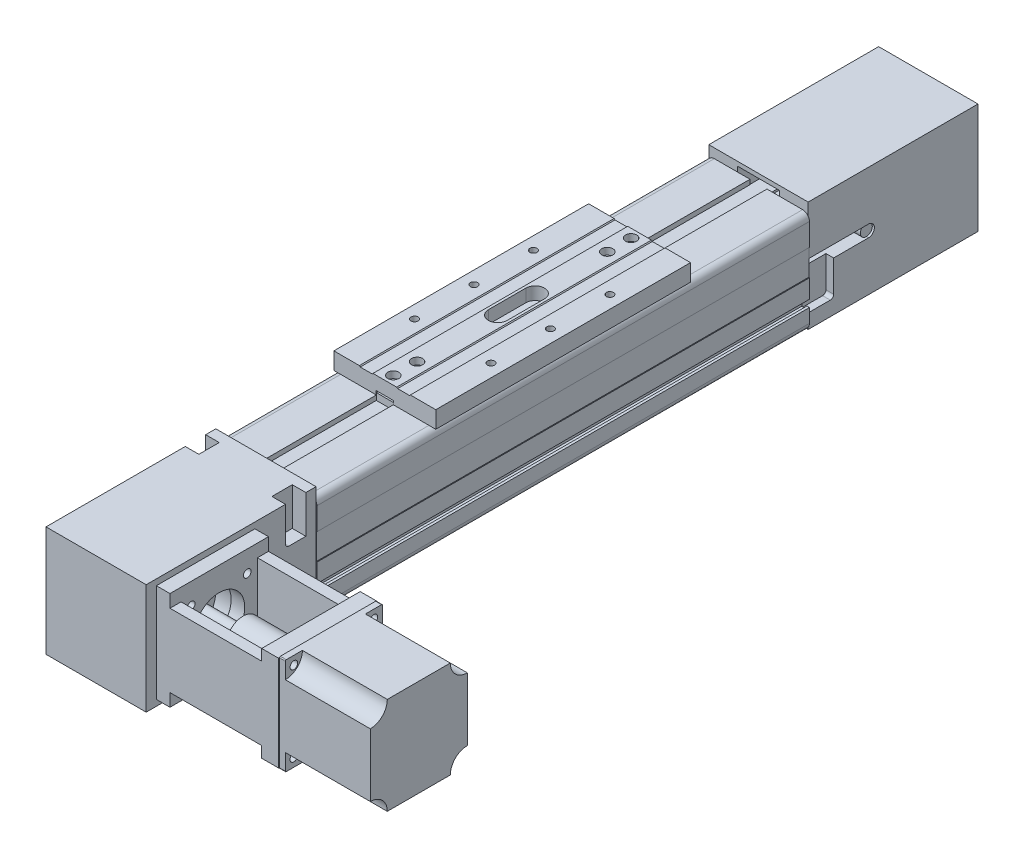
SolidWorks part; units mm, degrees
ref_plane "前视基准面" through (0, 0, 0) normal (0, 0, 1) x (1, 0, 0)
ref_plane "上视基准面" through (0, 0, 0) normal (0, 1, 0) x (1, 0, 0)
ref_plane "右视基准面" through (0, 0, 0) normal (1, 0, 0) x (0, 0, -1)
sketch "草图2" plane through (0, 0, 0) normal (0, 0, 1) x (1, 0, 0)
  line L0 (-87.6981, 0) -> (87.6981, 0) construction
  line L1 (0, -69.616) -> (0, 69.616) construction
  line L2 (-29.25, -32.5) -> (-29.25, 32.5)
  line L3 (29.25, -32.5) -> (29.25, 32.5)
  line L4 (-29.25, 32.5) -> (29.25, 32.5)
  line L5 (-29.25, -32.5) -> (29.25, -32.5)
  point P6 (0, 0)
  point P8 (-29.25, 0)
  point P12 (29.25, 0)
  dimension "D1" = 65
  dimension "D2" = 58.5
extrude "拉伸1" add sketch "草图2" along normal blind 100
sketch "草图3" plane through (0, 0, 100) normal (0, 0, 1) x (1, 0, 0)
  line L0 (0, -29.8615) -> (0, 29.8615) construction
  line L1 (-24.9311, 0) -> (24.9311, 0) construction
  line L2 (-12.5, -30) -> (-12.5, 30)
  line L3 (12.5, -30) -> (12.5, 30)
  line L4 (-12.5, 30) -> (12.5, 30)
  line L5 (-12.5, -30) -> (12.5, -30)
  point P6 (0, 0)
  point P8 (-12.5, 0)
  point P20 (12.5, 0)
  dimension "D1" = 25
  dimension "D2" = 30
extrude "拉伸2" cut sketch "草图3" against normal blind 52
sketch "草图4" plane through (-29.25, 0, 0) normal (-1, 0, 0) x (0, 0, 1)
  line L0 (0, 0) -> (100, 0) construction
  line L1 (100, 32.5) -> (100, -32.5) construction
  line L2 (64.5, 3.5) -> (100, 3.5)
  line L3 (64.5, -3.5) -> (100, -3.5)
  line L4 (100, -3.5) -> (100, 3.5)
  arc A0 (64.5, 3.5) -> (64.5, -3.5) centre (64.5, 0) ccw
  dimension "D1" = 7
  dimension "D2" = 35.5
extrude "拉伸3" cut sketch "草图4" against normal through all
sketch "草图5" plane through (-29.25, 0, 0) normal (-1, 0, 0) x (0, 0, 1)
  line L1 (100, -3.5) -> (85, -3.5)
  line L8 (64.5, -3.5) -> (100, -3.5) construction
  line L9 (85, -3.5) -> (85, -22)
  line L10 (87, -24) -> (100, -24)
  line L11 (100, -3.5) -> (100, -32.5) construction
  line L12 (100, -24) -> (100, -3.5)
  line L13 (100, -32.5) -> (0, -32.5) construction
  arc A1 (85, -22) -> (87, -24) centre (87, -22) ccw
  dimension "D6" = 2
  dimension "D4" = 8.5
  dimension "D5" = 15
extrude "拉伸4" cut sketch "草图5" against normal blind 4.5
mirror "镜向1" about plane through (0, 0, 0) normal (1, 0, 0) of "拉伸4"
sketch "草图10" plane through (-29.25, 0, 0) normal (-1, 0, 0) x (0, 0, 1)
  line L0 (64.5, 3.5) -> (64.5, -3.5) construction
  point P4 (64.5, 0)
ref_plane "基准面1" through (0, 0, 64.5) normal (0, 0, 1) x (1, 0, 0)
sketch "草图11" plane through (0, 0, 64.5) normal (0, 0, 1) x (1, 0, 0)
  line L0 (-29.25, 0) -> (29.25, 0) construction
  line L1 (29.25, -3.5) -> (29.25, 3.5) construction
  line L2 (0, 32.5) -> (0, -32.5) construction
  line L3 (29.25, 32.5) -> (-29.25, 32.5) construction
  line L4 (-29.25, -32.5) -> (29.25, -32.5) construction
  line L5 (-28, 0) -> (-28, 3.5)
  line L6 (-28, 3.5) -> (-10, 3.5)
  line L7 (-10, 3.5) -> (-10, 25)
  line L8 (-10, 25) -> (-5.2, 25)
  line L9 (-5.2, 25) -> (-5.2, 24)
  line L10 (-5.2, 24) -> (5.2, 24)
  line L11 (28, 0) -> (28, 3.5)
  line L12 (28, 3.5) -> (10, 3.5)
  line L13 (5.2, 25) -> (5.2, 24)
  line L14 (10, 25) -> (5.2, 25)
  line L15 (10, 3.5) -> (10, 25)
  line L16 (-28, 0) -> (28, 0)
  point P22 (0, 24)
  dimension "D1" = 56
  dimension "D2" = 10.4
  dimension "D3" = 20
  dimension "D4" = 25
  dimension "D5" = 24
revolve "旋转1" add sketch "草图11" angle 360 about L16
ref_plane "基准面2" through (0, 0, 390) normal (0, 0, 1) x (1, 0, 0)
sketch "草图12" plane through (0, 0, 390) normal (0, 0, 1) x (1, 0, 0)
  line L0 (0, -39.1606) -> (0, 39.1606) construction
  line L1 (-32.9855, 0) -> (32.9855, 0) construction
  line L2 (-29.5, 32.5) -> (-29.5, -32.5)
  line L3 (-29.5, 32.5) -> (29.5, 32.5)
  line L4 (29.5, 32.5) -> (29.5, -32.5)
  line L5 (-29.5, -32.5) -> (29.5, -32.5)
  point P6 (0, 0)
  point P9 (0, -32.5)
  point P11 (0, 32.5)
  point P12 (29.5, 0)
  point P13 (-29.5, 0)
  dimension "D1" = 65
  dimension "D2" = 59
extrude "拉伸9" add sketch "草图12" along normal blind 100
sketch "草图13" plane through (0, 32.5, 0) normal (0, 1, 0) x (1, 0, 0)
  line L0 (0, -390) -> (0, -490) construction
  line L1 (29.5, -390) -> (-29.5, -390) construction
  line L2 (29.5, -490) -> (-29.5, -490) construction
  line L3 (29.5, -490) -> (29.5, -390) construction
  line L4 (29.5, -396) -> (21.5, -396)
  line L5 (29.5, -396) -> (29.5, -408)
  line L6 (29.5, -408) -> (21.5, -408)
  line L7 (21.5, -396) -> (21.5, -408)
  line L8 (-21.5, -396) -> (-21.5, -408)
  line L9 (-29.5, -408) -> (-21.5, -408)
  line L10 (-29.5, -396) -> (-29.5, -408)
  line L11 (-29.5, -396) -> (-21.5, -396)
  dimension "D1" = 6
  dimension "D2" = 12
  dimension "D3" = 8
extrude "拉伸10" cut sketch "草图13" against normal blind 22.3
fillet "圆角1" radius 2 2 edges at (25.5, 10.2, 408) (-25.5, 10.2, 408)
sketch "草图16" plane through (-29.5, 0, 0) normal (-1, 0, 0) x (0, 0, 1)
  line L0 (490, -32.5) -> (390, -32.5) construction
  line L1 (490, 32.5) -> (490, -32.5) construction
  line L2 (455, -3.5) -> (455, 11.1352) construction
  circle A0 centre (455, -3.5) radius 18.5
  dimension "D2" = 37
  dimension "D1" = 35
  dimension "D3" = 29
extrude "拉伸13" cut sketch "草图16" against normal through all
sketch "草图17" plane through (0, 0, 390) normal (0, 0, -1) x (-1, 0, 0)
  line L0 (0, 0) -> (7.3583, 0) construction
  line L1 (0, 0) -> (0, 21.2702) construction
  line L2 (-15, 24.5) -> (15, 24.5) construction
  line L3 (-15, -24.5) -> (15, -24.5) construction
  line L4 (-15, 28.5) -> (15, 28.5)
  line L5 (-15, 20.5) -> (15, 20.5)
  line L6 (-15, -20.5) -> (15, -20.5)
  line L7 (-15, -28.5) -> (15, -28.5)
  arc A0 (15, 20.5) -> (15, 28.5) centre (15, 24.5) ccw
  arc A1 (-15, 20.5) -> (-15, 28.5) centre (-15, 24.5) cw
  arc A2 (-15, -20.5) -> (-15, -28.5) centre (-15, -24.5) ccw
  arc A3 (15, -20.5) -> (15, -28.5) centre (15, -24.5) cw
  point P7 (0, 24.5)
  point P17 (0, -24.5)
  point P18 (0, -21.2702)
  dimension "D3" = 8
  dimension "D1" = 30
  dimension "D2" = 49
extrude "拉伸14" cut sketch "草图17" against normal blind 90
sketch "草图18" plane through (-29.5, 0, 0) normal (-1, 0, 0) x (0, 0, 1)
  point P0 (455, -3.5)
ref_plane "基准面3" through (0, 0, 455) normal (0, 0, 1) x (1, 0, 0)
sketch "草图19" plane through (0, 0, 455) normal (0, 0, 1) x (1, 0, 0)
  line L0 (0, 0) -> (0, 18.6946) construction
  line L1 (0, 0) -> (-29.5, 0) construction
  line L2 (-28, 0) -> (-28, 4)
  line L3 (-28, 4) -> (-17, 4)
  line L4 (-17, 4) -> (-17, 29)
  line L5 (-17, 29) -> (-5.2, 29)
  line L6 (-5.2, 29) -> (-5.2, 24)
  line L7 (-5.2, 24) -> (5.2, 24)
  line L8 (5.2, 29) -> (5.2, 24)
  line L9 (17, 29) -> (5.2, 29)
  line L10 (17, 4) -> (17, 29)
  line L11 (17, 4) -> (51.5, 4)
  line L12 (51.5, 4) -> (51.5, 10)
  line L13 (51.5, 10) -> (81.5, 10)
  line L14 (81.5, 10) -> (81.5, 0)
  line L15 (0, 0) -> (82.9604, 0) construction
  line L16 (-28, 0) -> (81.5, 0)
  line L17 (-29.5, 32.5) -> (-29.5, -32.5) construction
  point P12 (0, 24)
  dimension "D1" = 34
  dimension "D2" = 28
  dimension "D3" = 10.4
  dimension "D4" = 4
  dimension "D5" = 10
  dimension "D6" = 34.5
  dimension "D7" = 30
  dimension "D8" = 25
  dimension "D9" = 24
revolve "旋转2" add sketch "草图19" angle 360 about L16
sketch "草图20" plane through (0, 0, 0) normal (1, 0, 0) x (0, 0, -1)
  line L0 (-64.5, 0) -> (-455, 0) construction
  line L1 (-455, 23) -> (-64.5, 23)
  line L2 (-64.5, -23) -> (-436.1569, -13.1885)
  line L3 (-455, 24.2) -> (-64.5, 24.2)
  line L4 (-64.516, -24.2) -> (-435.5541, -14.4048)
  arc A0 (-64.5, -23) -> (-64.5, 23) centre (-64.5, 0) ccw
  arc A1 (-455, 23) -> (-436.1569, -13.1885) centre (-455, 0) ccw
  arc A2 (-64.516, -24.2) -> (-64.5, 24.2) centre (-64.5, 0) ccw
  arc A3 (-455, 24.2) -> (-435.5541, -14.4048) centre (-455, 0) ccw
  dimension "D1" = 46
  dimension "D2" = 46
  dimension "D3" = 1.2
extrude "拉伸15" add sketch "草图20" along normal mid plane 10.4
sketch "草图21" plane through (0, 0, 100) normal (0, 0, 1) x (1, 0, 0)
  line L0 (0, 0) -> (0, 31.4578) construction
  line L1 (-5, 27) -> (-5, 22)
  line L2 (5, 27) -> (5, 22)
  line L3 (-26, -33) -> (26, -33)
  line L4 (-30, -29) -> (-30, 23)
  line L5 (-26, 27) -> (-5, 27)
  line L6 (-29.25, -32.5) -> (29.25, -32.5) construction
  line L7 (30, -29) -> (30, 23)
  line L8 (-5, 22) -> (5, 22)
  line L9 (5, 27) -> (26, 27)
  line L11 (-10, -23) -> (-10, -28)
  line L12 (10, -23) -> (10, -28)
  line L13 (-10, -23) -> (10, -23)
  line L14 (-10, -28) -> (10, -28)
  arc A0 (-30, 23) -> (-26, 27) centre (-26, 23) cw
  arc A1 (30, 23) -> (26, 27) centre (26, 23) ccw
  arc A2 (26, -33) -> (30, -29) centre (26, -29) ccw
  arc A3 (-26, -33) -> (-30, -29) centre (-26, -29) cw
  point P19 (-30, 27)
  point P24 (30, -33)
  point P27 (-30, -33)
  dimension "D10" = 4
  dimension "D1" = 60
  dimension "D2" = 0.5
  dimension "D3" = 60
  dimension "D4" = 30
  dimension "D5" = 5
  dimension "D6" = 10
  dimension "D7" = 5
  dimension "D8" = 20
  dimension "D9" = 5
extrude "拉伸17" add sketch "草图21" along normal up to surface (290 mm away)
sketch "草图22" plane through (0, 0, 100) normal (0, 0, -1) x (-1, 0, 0)
  line L0 (26, -33) -> (-26, -33) construction
  line L1 (29.75, -5.5) -> (30, -5.75)
  line L3 (0, -13) -> (0, 12.2435) construction
  line L4 (0, -13) -> (7.163, -13) construction
  line L5 (-30, -18.8) -> (30, -18.8) construction
  line L6 (-30, -29) -> (-30, 23) construction
  line L7 (30, 23) -> (30, -29) construction
  line L8 (-30, -16.7) -> (-30, -20.9)
  line L9 (-30, -20.9) -> (-28.5, -20.9)
  line L10 (-28.5, -20.9) -> (-28.5, -22.5)
  line L11 (-28.5, -22.5) -> (-25.5, -22.5)
  line L12 (-25.5, -22.5) -> (-25.5, -15.1)
  line L13 (-28.5, -15.1) -> (-25.5, -15.1)
  line L14 (-28.5, -16.7) -> (-28.5, -15.1)
  line L15 (-30, -16.7) -> (-28.5, -16.7)
  line L16 (26, -33) -> (-26, -33) construction
  line L17 (-30, 2) -> (30, 2) construction
  line L18 (-29.75, -5.5) -> (-29.75, 9.5)
  line L19 (-29.75, 9.5) -> (-30, 9.75)
  line L20 (-30, 9.75) -> (-30, -5.75)
  line L21 (-29.75, -5.5) -> (-30, -5.75)
  line L22 (30, 9.75) -> (30, -5.75)
  line L23 (29.75, 9.5) -> (30, 9.75)
  line L24 (29.75, -5.5) -> (29.75, 9.5)
  line L25 (30, -16.7) -> (28.5, -16.7)
  line L26 (28.5, -16.7) -> (28.5, -15.1)
  line L27 (28.5, -15.1) -> (25.5, -15.1)
  line L28 (25.5, -22.5) -> (25.5, -15.1)
  line L29 (28.5, -22.5) -> (25.5, -22.5)
  line L30 (28.5, -20.9) -> (28.5, -22.5)
  line L31 (30, -20.9) -> (28.5, -20.9)
  line L32 (30, -16.7) -> (30, -20.9)
  point P25 (-25.5, -18.8)
  point P37 (-29.75, 2)
  point P48 (29.75, 2)
  point P49 (25.5, -18.8)
  dimension "D1" = 14.2
  dimension "D2" = 4.2
  dimension "D3" = 7.4
  dimension "D4" = 4.5
  dimension "D5" = 3
  dimension "D6" = 20
  dimension "D7" = 15
  dimension "D8" = 135
  dimension "D9" = 59.5
extrude "拉伸19" cut sketch "草图22" against normal up to surface (290 mm away)
sketch "草图23" plane through (-29.5, 0, 0) normal (-1, 0, 0) x (0, 0, 1)
  line L0 (455, 0) -> (455, 28.9336) construction
  line L1 (455, 0) -> (368.1308, 0) construction
  line L2 (438.5, 16.5) -> (471.5, 16.5) construction
  line L3 (438.5, -16.5) -> (471.5, -16.5) construction
  point P10 (455, -16.5)
  point P11 (455, 16.5)
  dimension "D1" = 33
  dimension "D2" = 33
hole_wizard "M4 螺纹孔1" positions "3D草图1" profile "草图25" tap size "M4" standard "GB"
sketch3d "3D草图1"
  point P0 (-29.5, 16.5, 438.5)
  point P3 (-29.5, 16.5, 471.5)
  point P6 (-29.5, -16.5, 471.5)
  point P9 (-29.5, -16.5, 438.5)
sketch "草图25" plane through (-29.5, 16.5, 438.5) normal (0, 1, 0) x (0, 0, 1)
  line L0 (0, 0) -> (0, 111)
  line L1 (0, 111) -> (1.65, 111)
  line L2 (1.65, 111) -> (1.65, 0)
  line L5 (1.65, 0) -> (0, 0)
  line L11 (0, -6.35) -> (0, 107.95) construction
  dimension "通孔螺纹孔钻头直径" = 3.3
  dimension "通孔螺纹孔钻头深度" = 111
sketch "草图26" plane through (-29.5, 0, 0) normal (-1, 0, 0) x (0, 0, 1)
  line L0 (455, 0) -> (364.1606, 0) construction
  line L1 (455, 0) -> (455, 28.164) construction
  line L2 (426, 29) -> (484, 29)
  line L3 (426, -29) -> (484, -29)
  line L4 (484, 29) -> (484, -29)
  line L5 (426, 29) -> (426, -29)
  circle A0 centre (438.5, 16.5) radius 2.75
  circle A1 centre (438.5, -16.5) radius 2.75
  circle A2 centre (471.5, -16.5) radius 2.75
  circle A3 centre (471.5, 16.5) radius 2.75
  point P8 (455, 29)
  dimension "D3" = 5.5
  dimension "D1" = 58
  dimension "D2" = 58
extrude "拉伸20" add sketch "草图26" along normal blind 3
sketch "草图28" plane through (29.5, 0, 0) normal (1, 0, 0) x (0, 0, -1)
  line L0 (-998.338, 0) -> (88.338, 0) construction
  line L1 (-455, -35.4656) -> (-455, 35.4656) construction
  line L2 (-484, 29) -> (-426, 29)
  line L3 (-426, 29) -> (-426, -29)
  line L4 (-484, 29) -> (-484, -29)
  line L5 (-484, -29) -> (-426, -29)
  circle A0 centre (-471.5, 16.5) radius 2.25
  circle A1 centre (-438.5, 16.5) radius 2.25
  circle A2 centre (-438.5, -16.5) radius 2.25
  circle A3 centre (-471.5, -16.5) radius 2.25
  circle A4 centre (-455, 0) radius 15
  point P7 (-455, 0)
  point P10 (-455, -29)
  point P12 (-455, 29)
  point P13 (-484, 0)
  point P14 (-426, 0)
  dimension "D3" = 4.5
  dimension "D4" = 30
  dimension "D1" = 58
  dimension "D2" = 58
extrude "拉伸21" add sketch "草图28" along normal blind 8
sketch "草图29" plane through (37.5, 0, 0) normal (1, 0, 0) x (0, 0, -1)
  line L0 (-455, 0) -> (-455, 30.1249) construction
  line L1 (-455, 0) -> (-370.1833, 0) construction
  line L2 (-484, -21.5) -> (-484, 21.5)
  line L3 (-484, 29) -> (-484, -29) construction
  line L4 (-484, 21.5) -> (-477.5, 21.5)
  line L5 (-484, -21.5) -> (-477.5, -21.5)
  line L6 (-426, -21.5) -> (-426, 21.5)
  line L7 (-477.5, 21.5) -> (-477.5, -21.5)
  line L9 (-432.5, 21.5) -> (-432.5, -21.5)
  line L10 (-432.5, 21.5) -> (-426, 21.5)
  line L11 (-432.5, -21.5) -> (-426, -21.5)
  point P10 (-426, 0)
  point P12 (-484, 0)
  point P13 (-455, -10)
  point P14 (-455, 10)
  dimension "D1" = 43
  dimension "D2" = 45
extrude "拉伸22" add sketch "草图29" along normal blind 54
sketch "草图30" plane through (91.5, 0, 0) normal (1, 0, 0) x (0, 0, -1)
  line L0 (-455, 0) -> (-455, 33.8524) construction
  line L1 (-455, 0) -> (-369.4629, 0) construction
  line L2 (-484, -28) -> (-484, 28)
  line L3 (-484, 21.5) -> (-484, -21.5) construction
  line L4 (-426, -28) -> (-426, 28)
  line L5 (-484, 28) -> (-426, 28)
  line L6 (-484, -28) -> (-426, -28)
  circle A0 centre (-455, 0) radius 15
  point P11 (-484, 0)
  point P13 (-540.5371, 0)
  dimension "D1" = 30
  dimension "D2" = 56
extrude "拉伸23" add sketch "草图30" along normal blind 10
sketch "草图32" plane through (101.5, 0, 0) normal (1, 0, 0) x (0, 0, -1)
  line L0 (-455, -34.6272) -> (-455, 34.6272) construction
  line L1 (-1048.9899, 0) -> (138.9899, 0) construction
  line L2 (-478.55, -23.55) -> (-478.55, 23.55) construction
  line L3 (-431.45, -23.55) -> (-431.45, 23.55) construction
  point P7 (-455, 0)
  point P10 (-478.55, 0)
  dimension "D1" = 47.1
  dimension "D2" = 47.1
hole_wizard "M4 螺纹孔2" positions "3D草图2" profile "草图33" tap size "M4" standard "GB"
sketch3d "3D草图2"
  point P0 (101.5, 23.55, 478.55)
  point P3 (101.5, 23.55, 431.45)
  point P6 (101.5, -23.55, 431.45)
  point P9 (101.5, -23.55, 478.55)
sketch "草图33" plane through (101.5, 23.55, 478.55) normal (0, 1, 0) x (0, 0, -1)
  line L0 (0, 0) -> (0, 12.4914)
  line L1 (0, 12.4914) -> (1.65, 11.5)
  line L2 (1.65, 11.5) -> (1.65, 0)
  line L5 (1.65, 0) -> (0, 0)
  line L10 (0, 12.4914) -> (-1.65, 11.5) construction
  line L11 (0, -6.35) -> (0, 107.95) construction
  dimension "螺纹孔钻头直径" = 3.3
  dimension "螺纹孔钻头深度" = 11.5
  dimension "导头角度" = 118
sketch "草图34" plane through (101.5, 0, 0) normal (1, 0, 0) x (0, 0, -1)
  circle A0 centre (-455, 0) radius 19
  dimension "D1" = 38
extrude "拉伸25" cut sketch "草图34" against normal blind 3.5
sketch "草图35" plane through (98, 0, 0) normal (1, 0, 0) x (0, 0, -1)
  circle A0 centre (-455, 0) radius 18.5
  dimension "D1" = 37
extrude "拉伸26" add sketch "草图35" along normal blind 3.5
sketch "草图36" plane through (81.5, 0, 0) normal (1, 0, 0) x (0, 0, -1)
  circle A0 centre (-455, 0) radius 3.175
  dimension "D1" = 6.35
extrude "拉伸27" add sketch "草图36" along normal up to next
sketch "草图37" plane through (101.5, 0, 0) normal (1, 0, 0) x (0, 0, -1)
  line L0 (-455, -33.0395) -> (-455, 33.0395) construction
  line L1 (84.6261, 0) -> (-994.6261, 0) construction
  line L2 (-483.55, -28.55) -> (-483.55, 28.55)
  line L3 (-426.45, -28.55) -> (-426.45, 28.55)
  line L4 (-483.55, 28.55) -> (-426.45, 28.55)
  line L5 (-483.55, -28.55) -> (-426.45, -28.55)
  circle A0 centre (-478.55, 23.55) radius 2.25
  circle A1 centre (-478.55, -23.55) radius 2.25
  circle A2 centre (-431.45, -23.55) radius 2.25
  circle A3 centre (-431.45, 23.55) radius 2.25
  point P7 (-455, 0)
  point P10 (-483.55, 0)
  dimension "D3" = 4.5
  dimension "D1" = 57.1
  dimension "D2" = 57.1
extrude "拉伸28" add sketch "草图37" along normal blind 53.5
sketch "草图38" plane through (155, 0, 0) normal (1, 0, 0) x (0, 0, -1)
  line L0 (-455, 28.55) -> (-455, -28.55) construction
  line L1 (-426.45, 28.55) -> (-483.55, 28.55) construction
  line L2 (-483.55, -28.55) -> (-426.45, -28.55) construction
  line L3 (-483.55, 0) -> (-455, 0) construction
  line L4 (-483.55, 28.55) -> (-483.55, -28.55) construction
  circle A0 centre (-483.55, 28.55) radius 10
  circle A1 centre (-483.55, -28.55) radius 10
  circle A2 centre (-426.45, -28.55) radius 10
  circle A3 centre (-426.45, 28.55) radius 10
  dimension "D1" = 20
extrude "拉伸29" cut sketch "草图38" against normal blind 50
sketch "草图42" plane through (0, 24.2, 0) normal (0, 1, 0) x (1, 0, 0)
  line L0 (0, -100) -> (0, -390) construction
  line L1 (29.25, -100) -> (-29.25, -100) construction
  line L2 (29.5, -390) -> (-29.5, -390) construction
  line L3 (0, -245) -> (24.8646, -245) construction
  line L4 (-5, -170) -> (5, -170)
  line L5 (-5, -320) -> (5, -320)
  line L6 (5, -170) -> (5, -320)
  line L7 (-5, -170) -> (-5, -320)
  point P11 (0, -170)
  dimension "D1" = 10
  dimension "D2" = 150
extrude "拉伸31" add sketch "草图42" along normal blind 4
sketch "草图43" plane through (0, 0, 170) normal (0, 0, -1) x (-1, 0, 0)
  line L0 (0, 32.5) -> (0, -32.5) construction
  line L1 (-29.25, 32.5) -> (29.25, 32.5) construction
  line L2 (29.25, -32.5) -> (-29.25, -32.5) construction
  line L3 (5.25, 29.2) -> (-5.25, 29.2)
  line L4 (-5.25, 29.2) -> (-5.25, 27)
  line L5 (-5.25, 27) -> (-30, 27)
  line L6 (-30, 27) -> (-30, 37)
  line L7 (-30, 37) -> (-15, 37)
  line L8 (5.25, 29.2) -> (5.25, 27)
  line L9 (5.25, 27) -> (30, 27)
  line L10 (30, 27) -> (30, 37)
  line L11 (-7, 37) -> (7, 37)
  line L12 (-14.5, 36.5) -> (-7.5, 36.5)
  line L13 (7.5, 36.5) -> (14.5, 36.5)
  line L14 (15, 37) -> (30, 37)
  line L15 (-7, 37) -> (-7.5, 36.5)
  line L16 (26, -33) -> (-26, -33) construction
  line L17 (-15, 37) -> (-14.5, 36.5)
  line L18 (15, 37) -> (14.5, 36.5)
  line L19 (7, 37) -> (7.5, 36.5)
  point P9 (0, 29.2)
  point P16 (0, 27)
  point P20 (0, 34.9501)
  dimension "D1" = 10.5
  dimension "D2" = 10
  dimension "D3" = 3.3
  dimension "D4" = 14
  dimension "D5" = 60
  dimension "D6" = 7
  dimension "D7" = 30
  dimension "D8" = 70
  dimension "D9" = 0.5
extrude "拉伸32" add sketch "草图43" against normal blind 150
fillet "圆角9" radius 0.5 4 edges at (103.25, -28.55, 426.45) (103.25, -28.55, 483.55) (103.25, 28.55, 426.45) (103.25, 28.55, 483.55)
sketch "草图51" plane through (0, 0, 100) normal (0, 0, -1) x (-1, 0, 0)
  line L0 (-21, -25.5) -> (-21, -23.9786) construction
  line L1 (-26, -25.5) -> (-16, -25.5)
  line L2 (-26, -25.5) -> (-26, -29.5)
  line L3 (-26, -29.5) -> (-24, -29.5)
  line L4 (-16, -25.5) -> (-16, -29.5)
  line L5 (16, -25.5) -> (26, -25.5)
  line L6 (16, -25.5) -> (16, -29.5)
  line L7 (16, -29.5) -> (18, -29.5)
  line L8 (26, -25.5) -> (26, -29.5)
  line L9 (-18, -29.5) -> (-16, -29.5)
  line L10 (-24, -29.5) -> (-24, -34.2944)
  line L11 (-24, -34.2944) -> (-18, -34.2944)
  line L12 (-18, -29.5) -> (-18, -34.2944)
  line L13 (24, -29.5) -> (26, -29.5)
  line L14 (18, -29.5) -> (18, -34.8126)
  line L15 (18, -34.8126) -> (24, -34.8126)
  line L16 (24, -29.5) -> (24, -34.8126)
  line L17 (21, -25.5) -> (21, -22.6541) construction
  line L18 (26, -33) -> (-26, -33) construction
  line L19 (-30, -29) -> (-30, -20.9) construction
  dimension "D1" = 42
  dimension "D2" = 10
  dimension "D3" = 10
  dimension "D4" = 4
  dimension "D5" = 4
  dimension "D6" = 3.5
  dimension "D7" = 3.5
  dimension "D8" = 6
  dimension "D9" = 3
  dimension "D10" = 3
  dimension "D11" = 6
  dimension "D12" = 4
extrude "切除-拉伸1" cut sketch "草图51" along direction (0, 0, -1) on the side against the normal up to vertex (290 mm away)
sketch "草图52" plane through (0, 37, 0) normal (0, 1, 0) x (1, 0, 0)
  line L0 (-5.5, -231.5) -> (-5.5, -253.5)
  line L1 (5.5, -231.5) -> (5.5, -253.5)
  line L2 (-30, -320) -> (-30, -170) construction
  line L5 (5.25, -170) -> (26, -170) construction
  arc A0 (5.5, -231.5) -> (-5.5, -231.5) centre (0, -231.5) ccw
  arc A1 (-5.5, -253.5) -> (5.5, -253.5) centre (0, -253.5) ccw
  dimension "D2" = 30
  dimension "D1" = 11
  dimension "D3" = 22
  dimension "D4" = 61.5
extrude "切除-拉伸2" cut sketch "草图52" against normal blind 7.5
sketch "草图53" plane through (0, 37, 0) normal (0, 1, 0) x (1, 0, 0)
  line L0 (-30, -320) -> (-30, -170) construction
  line L1 (5.25, -170) -> (26, -170) construction
  circle A0 centre (0, -175) radius 1.7
  circle A1 centre (0, -189) radius 1.7
  circle A2 centre (0, -301) radius 1.7
  circle A3 centre (0, -315) radius 1.7
  dimension "D6" = 3.4
  dimension "D1" = 30
  dimension "D2" = 140
  dimension "D3" = 5
  dimension "D4" = 112
  dimension "D5" = 19
extrude "切除-拉伸3" cut sketch "草图53" against normal blind 9
hole_wizard "孔1" positions "草图55" profile "草图54" legacy
sketch "草图55" plane through (0, 37, 0) normal (0, 1, 0) x (-1, 0, 0)
  point P0 (0, 175)
  point P1 (0, 189)
  point P4 (0, 301)
  point P7 (0, 315)
sketch "草图54" plane through (0, 37, 175) normal (1, 0, 0) x (0, 0, 1)
  line L0 (0, 0) -> (0, 4)
  line L1 (0, 4) -> (3.25, 4)
  line L2 (3.25, 4) -> (3.25, 0)
  line L3 (3.25, 0) -> (0, 0)
  line L4 (0, 110) -> (0, -10) construction
  dimension "直径" = 6.5
  dimension "深度" = 4
hole_wizard "M5 螺纹孔1" positions "草图57" profile "草图56" tap size "M5" standard "GB"
sketch "草图57" plane through (0, 37, 0) normal (0, 1, 0) x (-1, 0, 0)
  line L0 (-30, 320) -> (-30, 170) construction
  line L1 (-15, 170) -> (-30, 170) construction
  line L2 (30, 170) -> (15, 170) construction
  point P0 (22.5, 280)
  point P1 (22.5, 245)
  point P3 (22.5, 210)
  point P5 (-22.5, 210)
  point P7 (-22.5, 245)
  point P9 (-22.5, 280)
  dimension "D1" = 45
  dimension "D2" = 7.5
  dimension "D3" = 70
  dimension "D4" = 40
  dimension "D5" = 75
  dimension "D6" = 40
  dimension "D7" = 70
  dimension "D8" = 75
  dimension "D9" = 7.5
  dimension "D10" = 7.5
  dimension "D11" = 45
  dimension "D12" = 45
sketch "草图56" plane through (-22.5, 37, 280) normal (1, 0, 0) x (0, 0, 1)
  line L0 (0, 0) -> (0, 11.2618)
  line L1 (0, 11.2618) -> (2.1, 10)
  line L2 (2.1, 10) -> (2.1, 0)
  line L5 (2.1, 0) -> (0, 0)
  line L10 (0, 11.2618) -> (-2.1, 10) construction
  line L11 (0, -6.35) -> (0, 107.95) construction
  dimension "螺纹孔钻头直径" = 4.2
  dimension "螺纹孔钻头深度" = 10
  dimension "导头角度" = 118
